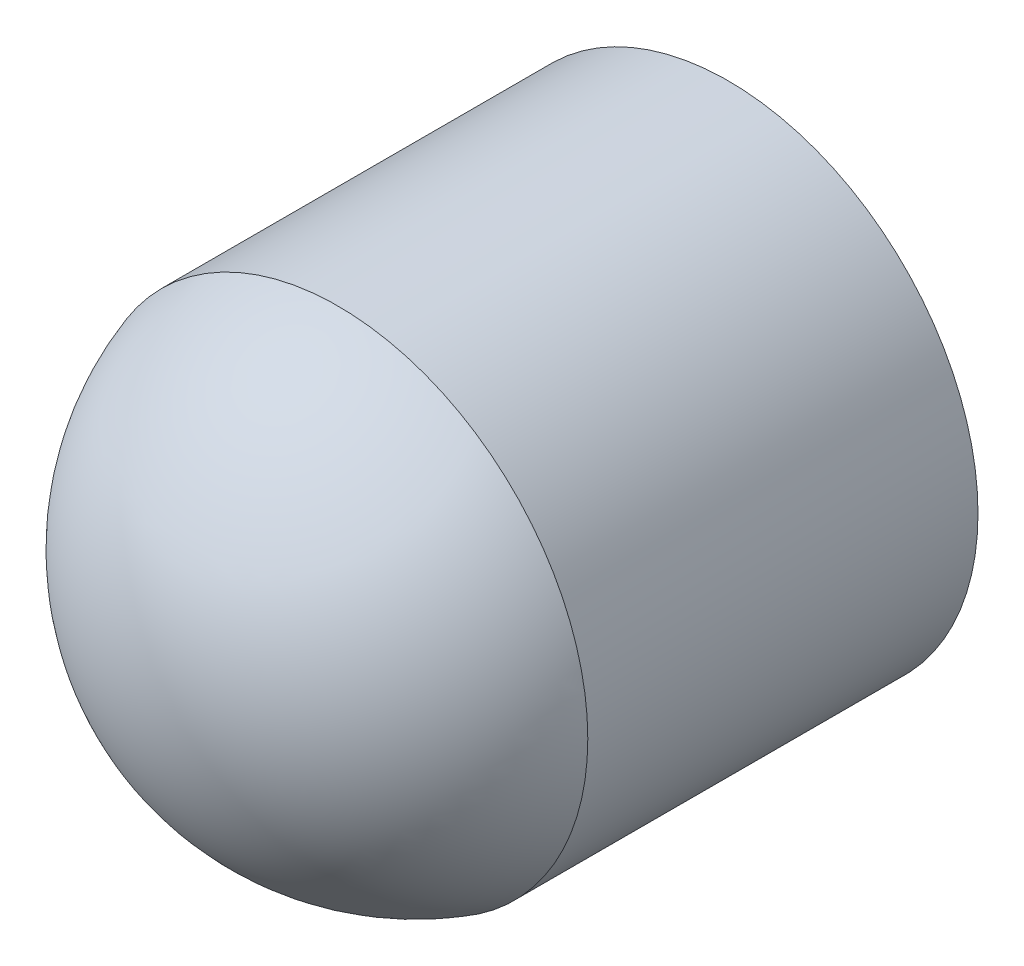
SolidWorks part; units mm, degrees
ref_plane "Front Plane" through (0, 0, 0) normal (0, 0, 1) x (1, 0, 0)
ref_plane "Top Plane" through (0, 0, 0) normal (0, 1, 0) x (1, 0, 0)
ref_plane "Right Plane" through (0, 0, 0) normal (1, 0, 0) x (0, 0, -1)
sketch "Sketch12" plane through (0, 0, 0) normal (1, 0, 0) x (0, 0, -1)
  line L0 (0, 0) -> (-1.484, 0)
  line L1 (0.716, 0) -> (0.716, -2.2) construction
  line L2 (0, 0) -> (0, -2.0802) construction
  line L3 (0, 0) -> (3.3408, 0)
  line L4 (0, 0) -> (3.5794, 0) construction
  line L5 (0.716, -2.2) -> (3.3408, -2.2)
  line L6 (3.3408, -2.2) -> (3.3408, 0)
  arc A0 (-1.484, 0) -> (0, -2.0802) centre (0.716, 0) ccw
  arc A1 (0, -2.0802) -> (0.716, -2.2) centre (0.716, 0) ccw
  dimension "D2" = 2.2
  dimension "D1" = 0.716
revolve "Revolve1" add sketch "Sketch12" angle 360 about L4
sketch "Sketch13" plane through (0, 0, 0) normal (0, 0, 1) x (1, 0, 0)
  circle A0 centre (0, 0) radius 2.1
  dimension "D1" = 4.2
extrude "Cut-Extrude1" cut sketch "Sketch13" against normal through all and the other way through all flip side to cut
sketch "Sketch14" plane through (0, 0, 0) normal (1, 0, 0) x (0, 0, -1)
  line L1 (1.8771, 2.9271) -> (0.5603, 2.9271)
  line L2 (1.8771, 2.9271) -> (1.8771, -3.0669)
  line L3 (1.8771, -3.0669) -> (0.5603, -3.0669)
  line L4 (0.5603, 2.9271) -> (0.5603, -3.0669)
  line L5 (0.0603, -2.1) -> (0.0603, 2.1) construction
  arc A0 (0.0603, 2.1) -> (0.0603, -2.1) centre (0.716, 0) ccw construction
  dimension "D1" = 2.0443
  dimension "D2" = 0.5
extrude "Cut-Extrude2" [suppressed] cut sketch "Sketch14" against normal through all and the other way through all
sketch "Sketch16" plane through (0, 0, 0) normal (0, 0, 1) x (1, 0, 0)
  circle A1 centre (0, 0) radius 1.7907
  circle A2 centre (0, 0) radius 1.7907 construction
